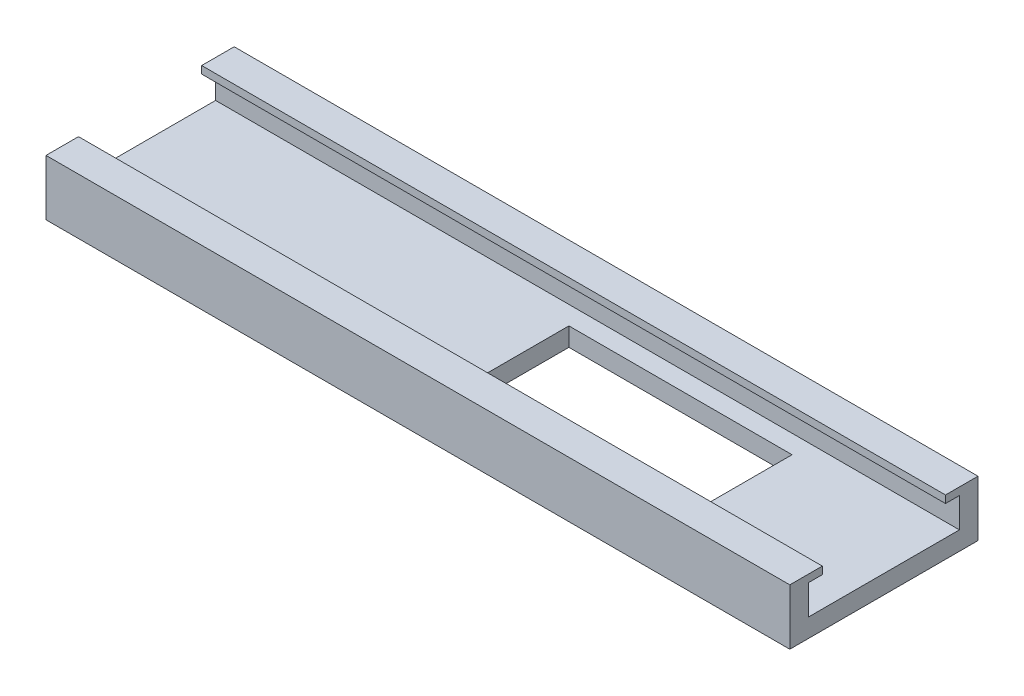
SolidWorks part; units mm, degrees
ref_plane "Front Plane" through (0, 0, 0) normal (0, 0, 1) x (1, 0, 0)
ref_plane "Top Plane" through (0, 0, 0) normal (0, 1, 0) x (1, 0, 0)
ref_plane "Right Plane" through (0, 0, 0) normal (1, 0, 0) x (0, 0, -1)
sketch "Sketch2" plane through (0, 0, 0) normal (1, 0, 0) x (0, 0, -1)
  line L0 (0, 0) -> (64.262, 0)
  line L1 (64.262, 0) -> (64.262, 19.05)
  line L2 (64.262, 19.05) -> (53.1622, 19.05)
  line L3 (53.1622, 19.05) -> (53.1622, 16.51)
  line L4 (53.1622, 16.51) -> (57.912, 16.51)
  line L5 (57.912, 16.51) -> (57.912, 6.35)
  line L6 (57.912, 6.35) -> (6.35, 6.35)
  line L7 (6.35, 6.35) -> (6.35, 16.51)
  line L8 (6.35, 16.51) -> (11.0998, 16.51)
  line L9 (11.0998, 16.51) -> (11.0998, 19.05)
  line L10 (11.0998, 19.05) -> (0, 19.05)
  line L11 (0, 19.05) -> (0, 0)
  point P3 (53.1622, 17.78)
  dimension "D1" = 4.7498
  dimension "D2" = 6.35
  dimension "D3" = 6.35
  dimension "D4" = 6.35
  dimension "D5" = 10.16
  dimension "D6" = 10.16
  dimension "D7" = 19.05
  dimension "D8" = 19.05
  dimension "D9" = 4.7498
  dimension "D10" = 51.562
extrude "Boss-Extrude1" add sketch "Sketch2" along normal blind 254
sketch "Sketch3" plane through (0, 6.35, 0) normal (0, 1, 0) x (1, 0, 0)
  line L0 (254, 64.262) -> (0, 64.262) construction
  line L1 (127, 13.462) -> (203.2, 13.462)
  line L2 (127, 13.462) -> (127, 51.562)
  line L3 (127, 51.562) -> (203.2, 51.562)
  line L4 (203.2, 13.462) -> (203.2, 51.562)
  line L5 (254, 57.912) -> (254, 6.35) construction
  dimension "D1" = 76.2
  dimension "D2" = 38.1
  dimension "D3" = 12.7
  dimension "D4" = 50.8
extrude "Cut-Extrude1" cut sketch "Sketch3" against normal through all
